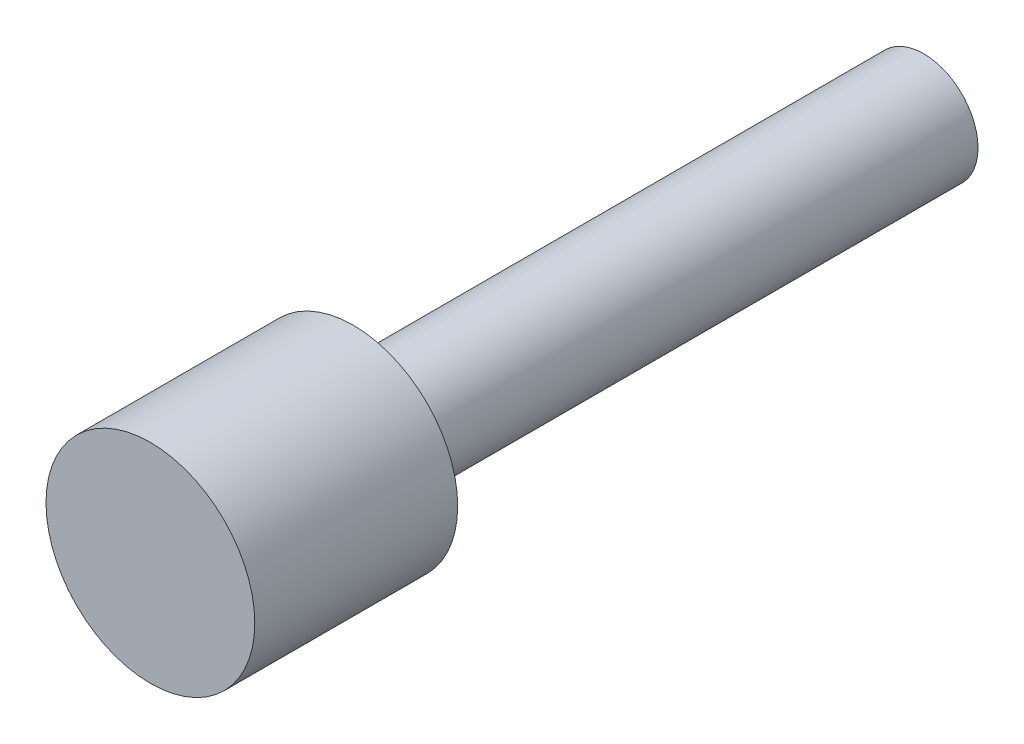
SolidWorks part; units mm, degrees
ref_plane "Front Plane" through (0, 0, 0) normal (0, 0, 1) x (1, 0, 0)
ref_plane "Top Plane" through (0, 0, 0) normal (0, 1, 0) x (1, 0, 0)
ref_plane "Right Plane" through (0, 0, 0) normal (1, 0, 0) x (0, 0, -1)
sketch "Sketch1" plane through (0, 0, 0) normal (0, 0, 1) x (1, 0, 0)
  circle A1 centre (0, 0) radius 4.2862 construction
  circle A2 centre (0, 0) radius 4.2862
extrude "Boss-Extrude1" add sketch "Sketch1" against normal up to vertex (8.3312 mm away)
sketch "Sketch2" plane through (0, 0, -8.3312) normal (0, 0, -1) x (-1, 0, 0)
  circle A0 centre (0, 0) radius 2.2327
  dimension "D1" = 4.4653
extrude "Boss-Extrude2" add sketch "Sketch2" along normal up to surface (23.4188 mm away)
